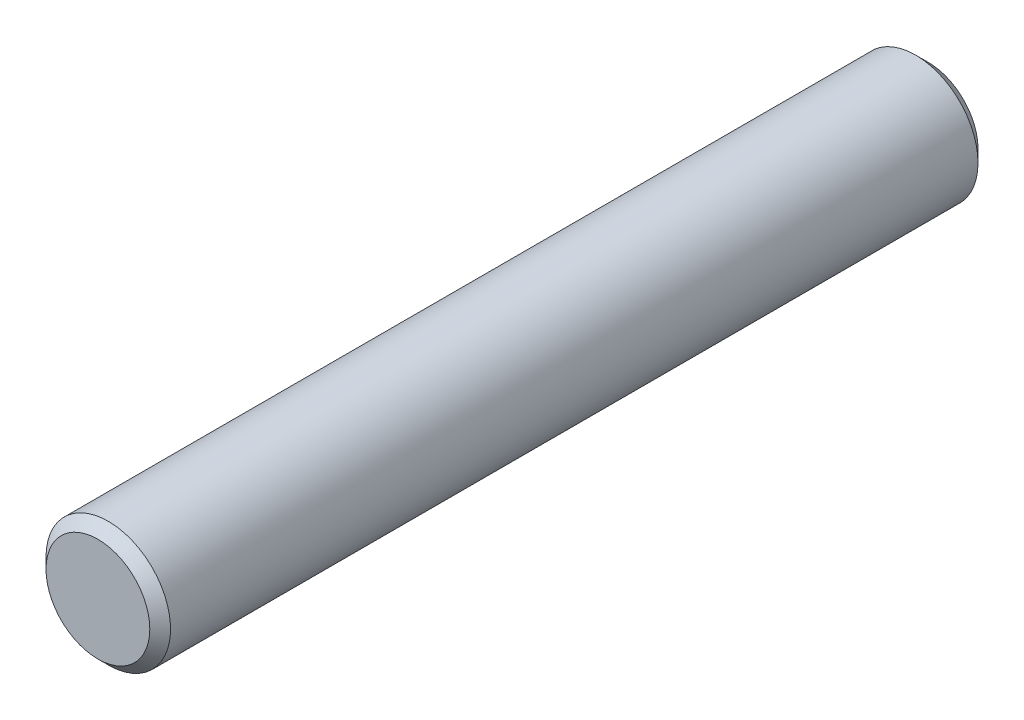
SolidWorks part; units mm, degrees
ref_plane "Front" through (0, 0, 0) normal (0, 0, 1) x (1, 0, 0)
ref_plane "Top" through (0, 0, 0) normal (0, 1, 0) x (1, 0, 0)
ref_plane "Right" through (0, 0, 0) normal (1, 0, 0) x (0, 0, -1)
sketch "Sketch1" plane through (0, 0, 0) normal (0, 0, 1) x (1, 0, 0)
  circle A0 centre (0, 0) radius 2.3813
  dimension "dia" = 4.7625
extrude "Extrude1" add sketch "Sketch1" along normal mid plane 76.2
sketch "Sketch2" plane through (0, 0, 0) normal (1, 0, 0) x (0, 0, -1)
  point P0 (-38.1, 2.3813)
  point P1 (38.1, 2.3813)
chamfer "Chamfer1" distance 0.4763 angle 45 2 edges at (2.3813, 0, -38.1) (2.3813, 0, 38.1)
sketch "Sketch3" plane through (0, 0, 38.1) normal (0, 0, 1) x (1, 0, 0)
  circle A0 centre (0, 0) radius 11.0078
extrude "Cut-Extrude1" cut sketch "Sketch3" against normal blind 44.45
chamfer "Chamfer2" distance 0.3969 angle 45 1 edges at (2.3813, 0, -6.35)
equation "\"D1@Chamfer1\" = \"dia@Sketch1\" * .1"
